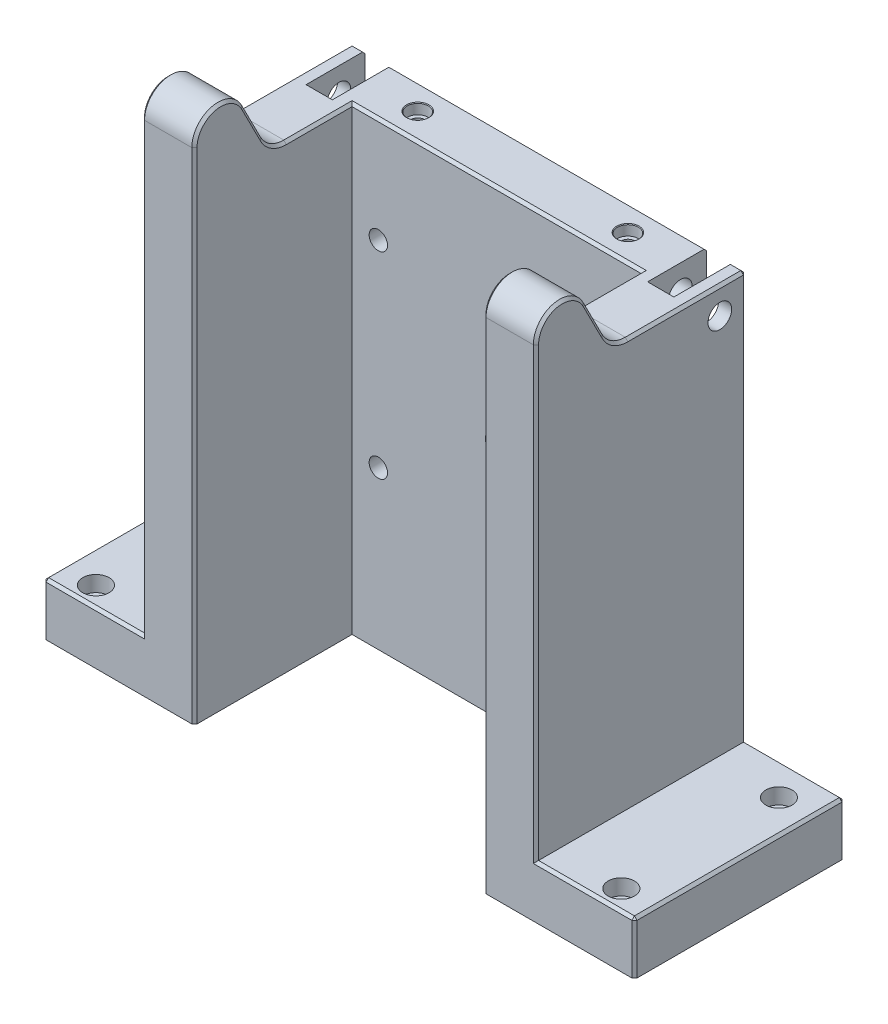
SolidWorks part; units mm, degrees
ref_plane "Plan de face" through (0, 0, 0) normal (0, 0, 1) x (1, 0, 0)
ref_plane "Plan de dessus" through (0, 0, 0) normal (0, 1, 0) x (1, 0, 0)
ref_plane "Plan de droite" through (0, 0, 0) normal (1, 0, 0) x (0, 0, -1)
sketch "Esquisse1" plane through (0, 0, 0) normal (0, 0, 1) x (1, 0, 0)
  line L0 (-225, 0) -> (225, 0)
  line L1 (225, 0) -> (225, 40)
  line L2 (225, 40) -> (150, 40)
  line L3 (150, 40) -> (150, 350)
  line L4 (150, 350) -> (-150, 350)
  line L5 (-150, 350) -> (-150, 40)
  line L6 (-150, 40) -> (-225, 40)
  line L7 (-225, 40) -> (-225, 0)
  dimension "D1" = 40
  dimension "D2" = 350
  dimension "D3" = 450
  dimension "D4" = 300
extrude "Boss.-Extru.1" add sketch "Esquisse1" along normal blind 160
hole_wizard "Chambrage pour vis à tête hexagonale M121" positions "Esquisse3" profile "Esquisse2" counterbore size "M12" standard "ISO"
sketch "Esquisse3" plane through (0, 40, 0) normal (0, 1, 0) x (-1, 0, 0)
  line L0 (225, 160) -> (225, 0) construction
  line L2 (150, 0) -> (225, 0) construction
  point P0 (200, 25)
  point P1 (-200, 25)
  point P16 (200, 145)
  point P18 (-200, 145)
  dimension "D1" = 400
  dimension "D2" = 25
  dimension "D3" = 25
  dimension "D4" = 120
sketch "Esquisse2" plane through (-200, 40, 25) normal (1, 0, 0) x (0, 0, 1)
  line L0 (0, 0) -> (0, 40)
  line L1 (0, 40) -> (6.75, 40)
  line L3 (6.75, 40) -> (6.75, 12)
  line L4 (6.75, 12) -> (10, 12)
  line L5 (10, 12) -> (10, 0)
  line L7 (10, 0) -> (0, 0)
  line L11 (0, -6.35) -> (0, 107.95) construction
  dimension "Diamètre du perçage jusqu'au prochain" = 13.5
  dimension "Profondeur du perçage jusqu'au prochain" = 40
  dimension "Diamètre du chambrage" = 20
  dimension "Profondeur du chambrage" = 12
hole_wizard "Trou taraudé M161" positions "Esquisse5" profile "Esquisse4" tap size "M16" standard "ISO"
sketch "Esquisse5" plane through (0, 0, 160) normal (0, 0, 1) x (1, 0, 0)
  line L0 (-225, 0) -> (225, 0) construction
  line L1 (150, 350) -> (-150, 350) construction
  point P0 (90, 270)
  point P1 (-90, 270)
  point P3 (-90, 120)
  point P7 (0, 0)
  dimension "D1" = 150
  dimension "D2" = 180
  dimension "D3" = 90
  dimension "D4" = 80
sketch "Esquisse4" plane through (90, 270, 160) normal (1, 0, 0) x (0, -1, 0)
  line L0 (0, 0) -> (0, 160)
  line L1 (0, 160) -> (7, 160)
  line L2 (7, 160) -> (7, 0)
  line L5 (7, 0) -> (0, 0)
  line L11 (0, -6.35) -> (0, 107.95) construction
  dimension "Diamètre du trou pour taraudage jusqu'au prochain" = 14
  dimension "Profondeur du trou pour taraudage jusqu'au prochain" = 160
hole_wizard "Diamètre du perçage Ø16.0 (16)1" positions "Esquisse9" profile "Esquisse8" hole size "Ø16.0" standard "ISO"
sketch "Esquisse9" plane through (0, 0, 160) normal (0, 0, 1) x (1, 0, 0)
  line L1 (0, -88) -> (0, 88) construction
  line L2 (-225, 0) -> (225, 0) construction
  point P0 (0, 180)
  dimension "D2" = 180
sketch "Esquisse8" plane through (0, 180, 160) normal (1, 0, 0) x (0, -1, 0)
  line L0 (0, 0) -> (0, 160)
  line L1 (0, 160) -> (8, 160)
  line L2 (8, 160) -> (8, 0)
  line L5 (8, 0) -> (0, 0)
  line L11 (0, -6.35) -> (0, 107.95) construction
  dimension "Diamètre du perçage jusqu'au prochain" = 16
  dimension "Profondeur du perçage jusqu'au prochain" = 160
sketch "Esquisse10" plane through (0, 0, 0) normal (0, -1, 0) x (1, 0, 0)
  line L0 (-225, 160) -> (225, 160) construction
  line L1 (-225, 0) -> (225, 0) construction
  line L10 (0, 0) -> (0, 40) construction
  line L13 (-110, 160) -> (110, 160)
  line L14 (-110, 160) -> (-110, 40)
  line L15 (-110, 40) -> (110, 40)
  line L16 (110, 160) -> (110, 40)
  dimension "D1" = 220
  dimension "D2" = 40
extrude "Enlèv. mat.-Extru.1" cut sketch "Esquisse10" against normal through all
hole_wizard "Trou taraudé M121" positions "Esquisse12" profile "Esquisse11" tap size "M12" standard "ISO"
sketch "Esquisse12" plane through (0, 350, 0) normal (0, 1, 0) x (-1, 0, 0)
  line L0 (-80, 20) -> (80, 20) construction
  line L1 (0, 0) -> (0, 20) construction
  line L2 (-150, 0) -> (150, 0) construction
  point P0 (-80, 20)
  point P1 (80, 20)
  dimension "D1" = 160
  dimension "D2" = 20
sketch "Esquisse11" plane through (80, 350, 20) normal (1, 0, 0) x (0, 0, 1)
  line L0 (0, 0) -> (0, 36.0644)
  line L1 (0, 36.0644) -> (5.1, 33)
  line L2 (5.1, 33) -> (5.1, 0)
  line L5 (5.1, 0) -> (0, 0)
  line L10 (0, 36.0644) -> (-5.1, 33) construction
  line L11 (0, -6.35) -> (0, 107.95) construction
  dimension "Diamètre du trou pour taraudage" = 10.2
  dimension "Profondeur du trou pour taraudage" = 33
  dimension "Angle de pointe" = 118
sketch "Esquisse13" plane through (0, 350, 0) normal (0, 1, 0) x (1, 0, 0)
  circle A0 centre (-80, -20) radius 8
  circle A1 centre (80, -20) radius 8
  dimension "D1" = 16
extrude "Alésage d16x8 pour pion de centrage" cut sketch "Esquisse13" against normal blind 8
sketch "Esquisse14" plane through (-150, 0, 0) normal (-1, 0, 0) x (0, 0, 1)
  line L0 (122.1829, 389.0857) -> (107.8171, 360.9143)
  line L1 (160, 350) -> (90, 350)
  line L2 (160, 350) -> (160, 380)
  line L3 (160, 350) -> (0, 350) construction
  arc A0 (160, 380) -> (122.1829, 389.0857) centre (140, 380) ccw
  arc A1 (90, 350) -> (107.8171, 360.9143) centre (90, 370) ccw
  dimension "D1" = 20
  dimension "D2" = 30
  dimension "D3" = 70
extrude "Boss.-Extru.3" add sketch "Esquisse14" against normal up to surface (40 mm away)
sketch "Esquisse15" plane through (150, 0, 0) normal (1, 0, 0) x (0, 0, -1)
  line L0 (-122.1829, 389.0857) -> (-107.8171, 360.9143) construction
  line L1 (-160, 350) -> (-90, 350) construction
  line L2 (-160, 350) -> (-160, 380) construction
  line L3 (-122.1829, 389.0857) -> (-107.8171, 360.9143)
  line L4 (-160, 350) -> (-90, 350)
  line L5 (-160, 350) -> (-160, 380)
  arc A0 (-107.8171, 360.9143) -> (-90, 350) centre (-90, 370) ccw construction
  arc A1 (-122.1829, 389.0857) -> (-160, 380) centre (-140, 380) ccw construction
  arc A2 (-107.8171, 360.9143) -> (-90, 350) centre (-90, 370) ccw
  arc A3 (-122.1829, 389.0857) -> (-160, 380) centre (-140, 380) ccw
extrude "Boss.-Extru.4" add sketch "Esquisse15" against normal up to surface (40 mm away)
sketch "Esquisse16" plane through (0, 350, 0) normal (0, 1, 0) x (1, 0, 0)
  line L1 (140, 0) -> (120, 0)
  line L2 (140, 0) -> (140, -45)
  line L3 (140, -45) -> (120, -45)
  line L4 (120, 0) -> (120, -45)
  line L5 (150, 0) -> (-150, 0) construction
  line L6 (-140, 0) -> (-120, 0)
  line L7 (-140, 0) -> (-140, -45)
  line L8 (-140, -45) -> (-120, -45)
  line L9 (-120, 0) -> (-120, -45)
  line L11 (-140, -22.5) -> (-150, -22.5) construction
  line L12 (-150, -160) -> (-150, 0) construction
  line L13 (140, -22.5) -> (150, -22.5) construction
  line L14 (150, -160) -> (150, 0) construction
  dimension "D1" = 45
  dimension "D2" = 20
  dimension "D3" = 10
extrude "Enlèv. mat.-Extru.2" cut sketch "Esquisse16" against normal blind 50
fillet "Congé1" radius 8 4 edges at (140, 300, 22.5) (120, 300, 22.5) (-140, 300, 22.5) (-120, 300, 22.5)
hole_wizard "Diamètre du perçage Ø18.0 (18)1" positions "Esquisse18" profile "Esquisse17" hole size "Ø18.0" standard "ISO"
sketch "Esquisse18" plane through (-150, -28.5071, 40.4266) normal (-1, 0, 0) x (0, 0, 1)
  line L2 (-40.4266, 378.5071) -> (-40.4266, 68.5071) construction
  line L3 (49.5734, 378.5071) -> (-40.4266, 378.5071) construction
  point P10 (-20.4266, 358.5071)
  dimension "D1" = 20
  dimension "D2" = 20
sketch "Esquisse17" plane through (-150, 330, 20) normal (0, 1, 0) x (0, 0, 1)
  line L0 (0, 0) -> (0, 55.4077)
  line L1 (0, 55.4077) -> (9, 50)
  line L2 (9, 50) -> (9, 0)
  line L5 (9, 0) -> (0, 0)
  line L10 (0, 55.4077) -> (-9, 50) construction
  line L11 (0, -6.35) -> (0, 107.95) construction
  dimension "Diamètre du perçage" = 18
  dimension "Profondeur du perçage" = 50
  dimension "Angle de pointe" = 118
mirror "Symétrie1" about plane through (0, 0, 0) normal (1, 0, 0) of "Diamètre du perçage Ø18.0 (18)1"
chamfer "Chanfrein1" distance 2 angle 45 36 edges at (-145, 350, 0) (0, 350, 0) (145, 350, 0) (110, 190, 160) (110, 399.4466, 144.6721) (150, 399.4466, 144.6721) (110, 375, 115) (150, 375, 115) (110, 352.9455, 100.4472) (150, 352.9455, 100.4472) (110, 350, 65) (0, 350, 40) (-110, 350, 65) (-110, 352.9455, 100.4472) (-150, 352.9455, 100.4472) (-110, 375, 115) (-150, 375, 115) (-110, 399.4466, 144.6721) (-150, 399.4466, 144.6721) (-110, 190, 160) (-150, 350, 45) (-150, 210, 160) (-187.5, 40, 160) (-225, 20, 160) (-225, 40, 80) (-225, 20, 0) (-187.5, 40, 0) (-150, 195, 0) (150, 350, 45) (150, 210, 160) (225, 20, 160) (187.5, 40, 160) (225, 40, 80) (225, 20, 0) (187.5, 40, 0) (150, 195, 0)
chamfer "Chanfrein2" distance 0.5 angle 45 4 edges at (-80, 350, 28) (80, 350, 28) (8, 180, 0) (-8, 180, 40)
hole_wizard "Diamètre du perçage Ø18.0 (18)2" positions "Esquisse20" profile "Esquisse19" hole size "Ø18.0" standard "ISO"
sketch "Esquisse20" plane through (0, 0, 0) normal (0, -1, 0) x (1, 0, 0)
  line L0 (200, 25) -> (200, 145) construction
  line L2 (-200, 25) -> (-200, 145) construction
  line L3 (200, 65) -> (160, 65) construction
  line L5 (-200, 65) -> (-160, 65) construction
  point P0 (160, 65)
  point P11 (-160, 65)
  dimension "D1" = 40
  dimension "D2" = 320
sketch "Esquisse19" plane through (160, 0, 65) normal (1, 0, 0) x (0, 0, -1)
  line L0 (0, 0) -> (0, 25.4077)
  line L1 (0, 25.4077) -> (9, 20)
  line L2 (9, 20) -> (9, 0)
  line L5 (9, 0) -> (0, 0)
  line L10 (0, 25.4077) -> (-9, 20) construction
  line L11 (0, -6.35) -> (0, 107.95) construction
  dimension "Diamètre du perçage" = 18
  dimension "Profondeur du perçage" = 20
  dimension "Angle de pointe" = 118
chamfer "Chanfrein3" distance 1 angle 45 2 edges at (160, 0, 56) (-160, 0, 56)
